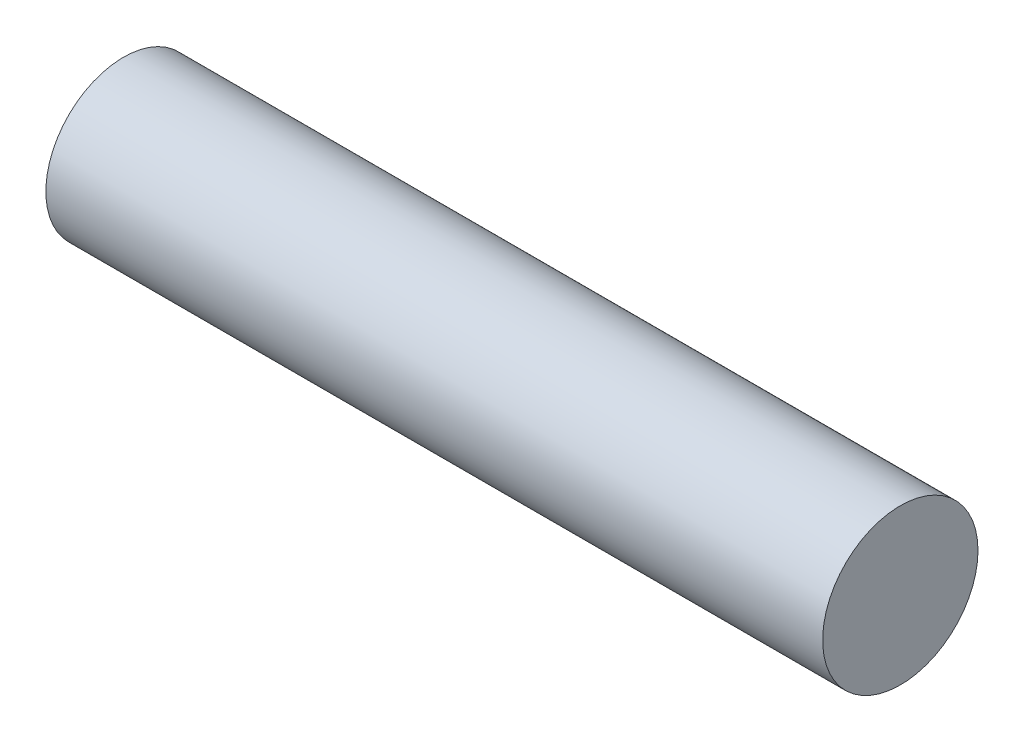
SolidWorks part; units mm, degrees
ref_plane "Front Plane" through (0, 0, 0) normal (0, 0, 1) x (1, 0, 0)
ref_plane "Top Plane" through (0, 0, 0) normal (0, 1, 0) x (1, 0, 0)
ref_plane "Right Plane" through (0, 0, 0) normal (1, 0, 0) x (0, 0, -1)
body saved out of another part "Stock-Toaster Test-1"
